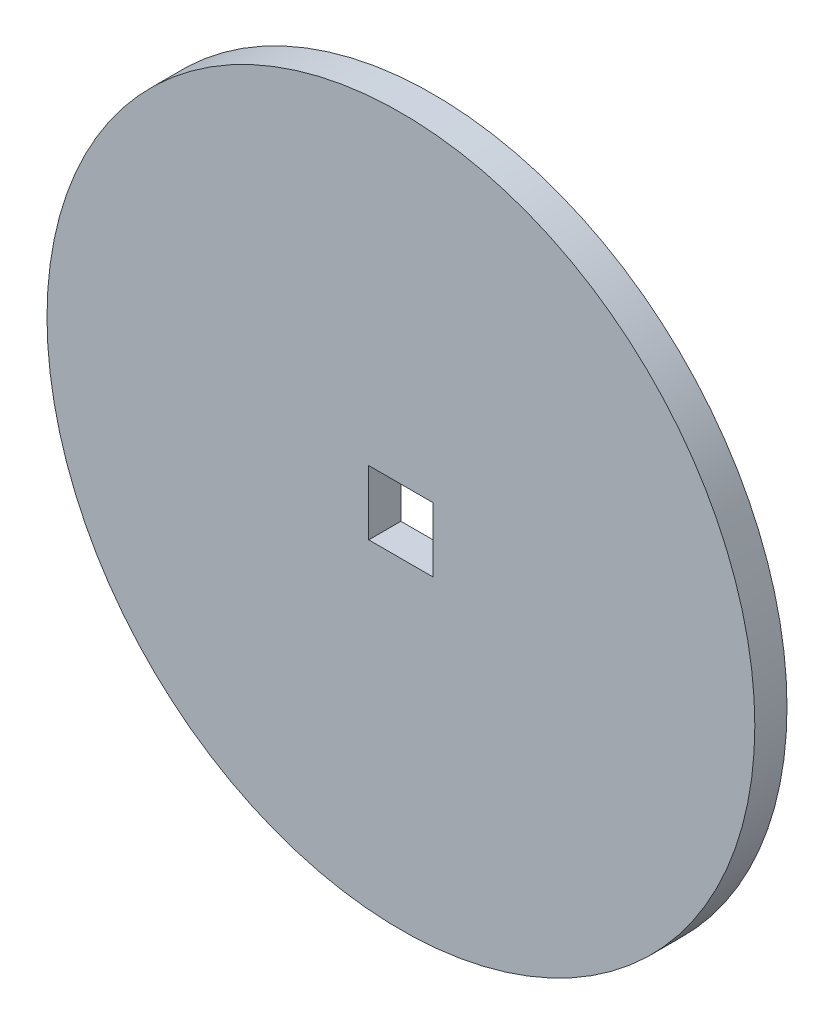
SolidWorks part; units mm, degrees
ref_plane "Front Plane" through (0, 0, 0) normal (0, 0, 1) x (1, 0, 0)
ref_plane "Top Plane" through (0, 0, 0) normal (0, 1, 0) x (1, 0, 0)
ref_plane "Right Plane" through (0, 0, 0) normal (1, 0, 0) x (0, 0, -1)
sketch "Sketch1" plane through (0, 0, 0) normal (0, 0, 1) x (1, 0, 0)
  line L1 (-54.0434, 23.2698) -> (-47.6934, 23.2698)
  line L2 (-54.0434, 23.2698) -> (-54.0434, 29.6198)
  line L3 (-54.0434, 29.6198) -> (-47.6934, 29.6198)
  line L4 (-47.6934, 23.2698) -> (-47.6934, 29.6198)
  line L5 (-54.0434, 23.2698) -> (-47.6934, 29.6198) construction
  line L6 (-54.0434, 29.6198) -> (-47.6934, 23.2698) construction
  circle A0 centre (-50.8684, 26.4448) radius 34.925
  dimension "D3" = 69.85
  dimension "D1" = 6.35
  dimension "D2" = 6.35
extrude "Boss-Extrude1" add sketch "Sketch1" along normal blind 3.175
